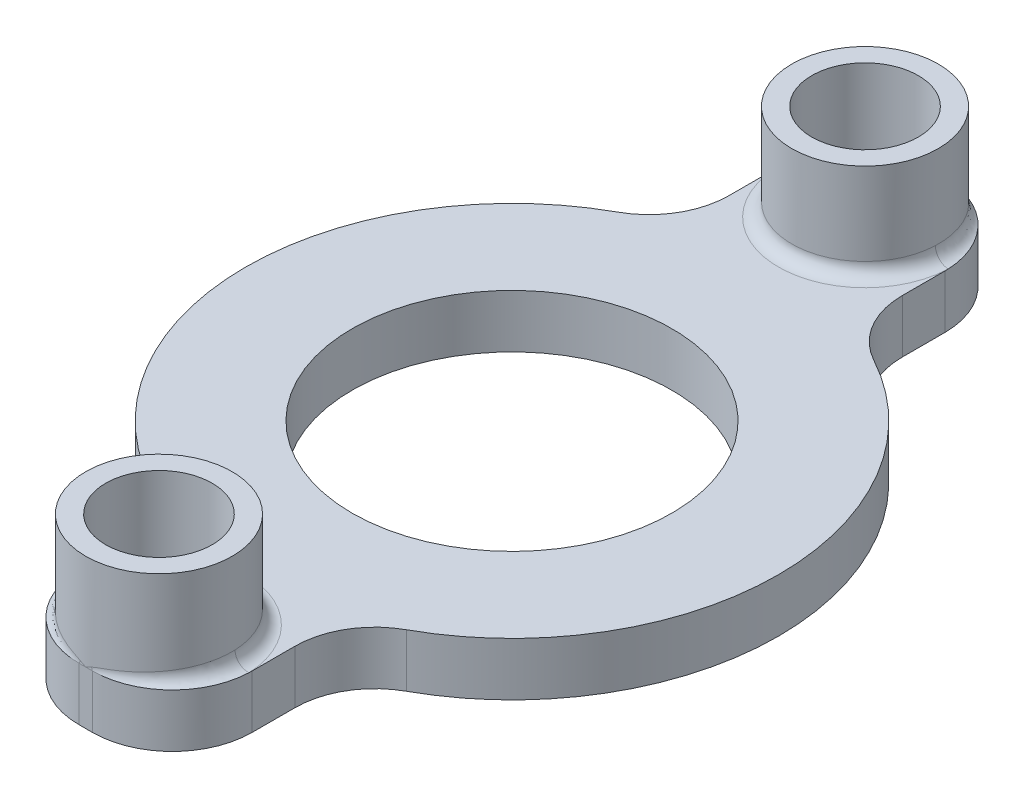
SolidWorks part; units mm, degrees
ref_plane "Front Plane" through (0, 0, 0) normal (0, 0, 1) x (1, 0, 0)
ref_plane "Top Plane" through (0, 0, 0) normal (0, 1, 0) x (1, 0, 0)
ref_plane "Right Plane" through (0, 0, 0) normal (1, 0, 0) x (0, 0, -1)
sketch "Sketch1" plane through (0, 0, 0) normal (0, 1, 0) x (1, 0, 0)
  line L0 (-3.25, 9.4571) -> (-3.25, 16)
  line L1 (-3.25, 16) -> (3.25, 16)
  line L2 (3.25, 16) -> (3.25, 9.4571)
  line L3 (-3.25, -9.4571) -> (-3.25, -16)
  line L4 (-3.25, -16) -> (3.25, -16)
  line L5 (3.25, -16) -> (3.25, -9.4571)
  circle A0 centre (0, 0) radius 10
  point P9 (0, 16)
  point P12 (0, -16)
  dimension "D1" = 20
  dimension "D2" = 32
  dimension "D3" = 6.5
extrude "Boss-Extrude1" add sketch "Sketch1" along normal blind 2 contours A0 | A0 L3 L4 L5 | A0 L2 L1 L0
sketch "Sketch3" plane through (0, 2, 0) normal (0, 1, 0) x (1, 0, 0)
  circle A0 centre (0, 0) radius 6
  dimension "D1" = 12
extrude "Cut-Extrude1" cut sketch "Sketch3" against normal through all
sketch "Sketch4" plane through (0, 2, 0) normal (0, 1, 0) x (1, 0, 0)
  line L0 (-3.25, -16) -> (3.25, -16) construction
  line L1 (-3.25, 16) -> (3.25, 16) construction
  circle A0 centre (0, -13.25) radius 2.75
  circle A1 centre (0, 13.25) radius 2.75
  dimension "D1" = 5.5
  dimension "D2" = 5.5
extrude "Boss-Extrude2" add sketch "Sketch4" along normal blind 3.6
sketch "Sketch5" plane through (0, 5.6, 0) normal (0, 1, 0) x (1, 0, 0)
  circle A0 centre (0, 13.25) radius 2
  circle A2 centre (0, -13.25) radius 2
  dimension "D1" = 4
  dimension "D2" = 4
extrude "Cut-Extrude2" cut sketch "Sketch5" against normal through all
fillet "Fillet1" radius 3 8 edges at (3.25, 1, -16) (-3.25, 1, -16) (-3.25, 1, 16) (3.25, 1, 16) (-3.25, 1, -9.4571) (-3.25, 1, 9.4571) (3.25, 1, 9.4571) (3.25, 1, -9.4571)
fillet "Fillet4" radius 0.5 2 edges at (0, 2, 16) (0, 2, -10.5)
